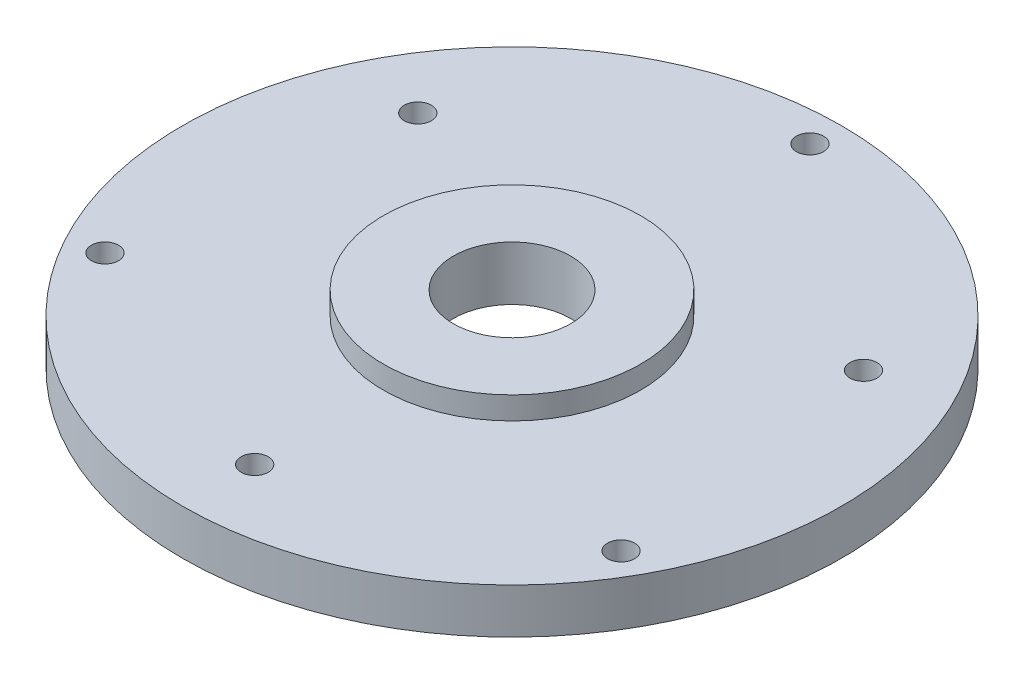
SolidWorks part; units mm, degrees
ref_plane "Piano frontale" through (0, 0, 0) normal (0, 0, 1) x (1, 0, 0)
ref_plane "Piano superiore" through (0, 0, 0) normal (0, 1, 0) x (1, 0, 0)
ref_plane "Piano destro" through (0, 0, 0) normal (1, 0, 0) x (0, 0, -1)
sketch "Schizzo1" plane through (0, 0, 0) normal (0, 0, 1) x (1, 0, 0)
  line L0 (0, 0) -> (0, 68.8521) construction
  line L4 (36.5, 39.3859) -> (36.5, 34.3859)
  line L10 (13, 34.3859) -> (36.5, 34.3859)
  line L11 (13, 34.3859) -> (13, 35.8859)
  line L12 (13, 35.8859) -> (6.5, 35.8859)
  line L15 (6.5, 41.8859) -> (14.25, 41.8859)
  line L16 (14.25, 41.8859) -> (14.25, 39.3859)
  line L17 (6.5, 35.8859) -> (6.5, 41.8859)
  line L18 (14.25, 39.3859) -> (36.5, 39.3859)
  dimension "D1" = 14.25
  dimension "D2" = 36.5
  dimension "D3" = 1.5
  dimension "D4" = 2.5
  dimension "D5" = 6.5
  dimension "D6" = 5
  dimension "D7" = 13
revolve "Rivoluzione1" add sketch "Schizzo1" angle 360 about L0
sketch "Schizzo2" plane through (0, 39.3859, 0) normal (0, 1, 0) x (1, 0, 0)
  circle A0 centre (0, 33) radius 1.5
  circle A1 centre (28.5788, -16.5) radius 1.5
  circle A2 centre (-28.5788, -16.5) radius 1.5
  point P10 (0, 0)
  dimension "D1" = 3
  dimension "D2" = 33
  dimension "D3" = 3
extrude "Taglio-Estrusione1" cut sketch "Schizzo2" against normal through all
sketch "Schizzo6" plane through (0, 34.3859, 0) normal (0, -1, 0) x (-1, 0, 0)
  circle A0 centre (0, -28.5) radius 1.5
  circle A1 centre (-24.6817, 14.25) radius 1.5
  circle A2 centre (24.6817, 14.25) radius 1.5
  point P10 (0, 0)
  dimension "D1" = 28.5
  dimension "D3" = 3
  dimension "D2" = 3
extrude "Taglio-Estrusione3" cut sketch "Schizzo6" against normal through all contours A1
